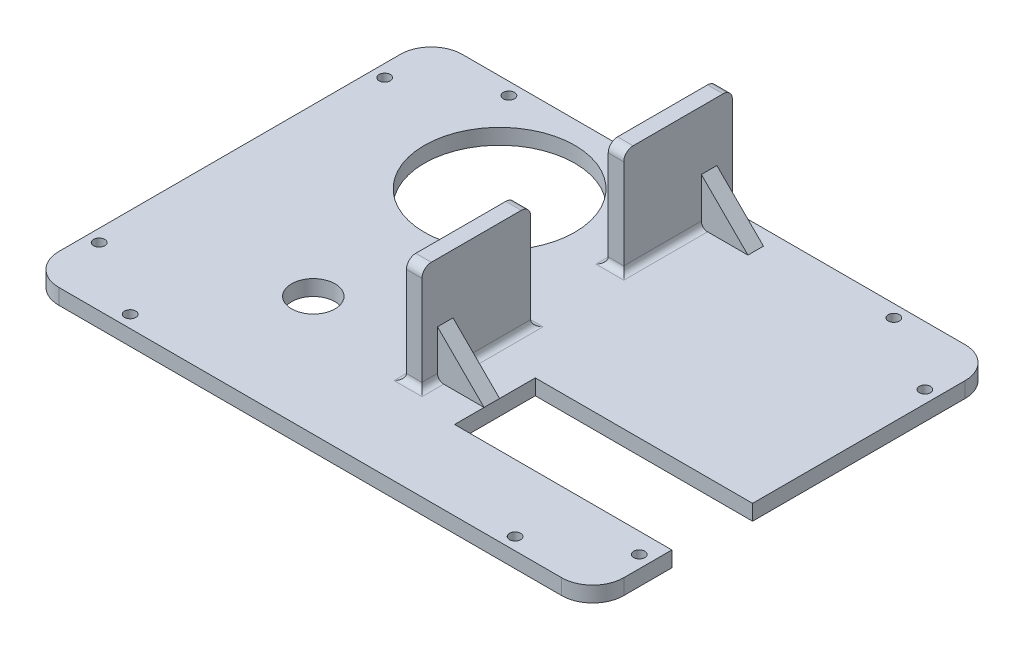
SolidWorks part; units mm, degrees
ref_plane "Front Plane" through (0, 0, 0) normal (0, 0, 1) x (1, 0, 0)
ref_plane "Top Plane" through (0, 0, 0) normal (0, 1, 0) x (1, 0, 0)
ref_plane "Right Plane" through (0, 0, 0) normal (1, 0, 0) x (0, 0, -1)
sketch "Sketch1" plane through (0, 0, 0) normal (0, 1, 0) x (1, 0, 0)
  line L26 (128.5, 13) -> (58.5, 13)
  line L27 (-43.5, 91.5) -> (118.5, 91.5)
  line L28 (-53.5, 81.5) -> (-53.5, -28.5)
  line L29 (-43.5, -38.5) -> (118.5, -38.5)
  line L30 (128.5, 81.5) -> (128.5, -28.5)
  line L31 (58.5, 13) -> (58.5, -13)
  line L32 (58.5, -13) -> (128.5, -13)
  circle A17 centre (0, 60) radius 24.25
  circle A18 centre (0, 0) radius 7
  arc A19 (-43.5, 91.5) -> (-53.5, 81.5) centre (-43.5, 81.5) ccw
  arc A20 (118.5, 91.5) -> (128.5, 81.5) centre (118.5, 81.5) cw
  arc A21 (118.5, -38.5) -> (128.5, -28.5) centre (118.5, -28.5) ccw
  arc A22 (-53.5, -28.5) -> (-43.5, -38.5) centre (-43.5, -28.5) ccw
  point P37 (0, 0)
  dimension "D3" = 60
  dimension "D4" = 10
  dimension "D5" = 130
  dimension "D6" = 38.5
  dimension "D7" = 25.5
  dimension "D22" = 48.5
  dimension "D1" = 14
  dimension "D20" = 26
  dimension "D21" = 70
extrude "Boss-Extrude1" add sketch "Sketch1" along normal blind 5
sketch "Sketch4" plane through (0, 5, 0) normal (0, 1, 0) x (1, 0, 0)
  line L0 (43.5, 91.5) -> (43.5, 56.5)
  line L1 (-53.5, 81.5) -> (-53.5, -28.5) construction
  line L2 (43.5, -8.5) -> (38.5, -8.5)
  line L3 (38.5, -8.5) -> (38.5, 26.5)
  line L4 (38.5, 91.5) -> (43.5, 91.5)
  line L5 (-43.5, 91.5) -> (118.5, 91.5) construction
  line L6 (38.5, 56.5) -> (43.5, 56.5)
  line L7 (38.5, 26.5) -> (43.5, 26.5)
  line L8 (43.5, 26.5) -> (43.5, -8.5)
  line L9 (38.5, 56.5) -> (38.5, 91.5)
  dimension "D1" = 97
  dimension "D2" = 5
  dimension "D3" = 100
  dimension "D4" = 35
  dimension "D5" = 35
extrude "Boss-Extrude3" add sketch "Sketch4" along normal blind 34
other "Gusset1" parameters "D1"=5, "D2"=5, "D3"=0, "D4"=0, "D10"=5, "D11"=15, "D12"=15, "D13"=15, "D14"=45, "D15"=15, "D16"=5, "D17"=5, "D18"=45
sketch "Sketch5" plane through (38.5, 5, -74) normal (0, 0, -1) x (-1, 0, 0)
  line L0 (0, 0) -> (15, 0)
  line L1 (0, 0) -> (0, 15)
  line L2 (15, 0) -> (0, 15)
other "Gusset2" parameters "D1"=5, "D2"=5, "D3"=0, "D4"=0, "D10"=5, "D11"=15, "D12"=15, "D13"=15, "D14"=45, "D15"=15, "D16"=7.5, "D17"=7.5, "D18"=45
sketch "Sketch6" plane through (38.5, 5, -21.5) normal (0, 0, 1) x (1, 0, 0)
  line L0 (0, 0) -> (-15, 0)
  line L1 (0, 0) -> (0, 15)
  line L2 (-15, 0) -> (0, 15)
other "Gusset3" parameters "D1"=5, "D2"=5, "D3"=0, "D4"=0, "D10"=5, "D11"=15, "D12"=15, "D13"=15, "D14"=45, "D15"=15, "D16"=7.5, "D17"=7.5, "D18"=45
sketch "Sketch7" plane through (43.5, 5, -86.5) normal (0, 0, 1) x (1, 0, 0)
  line L0 (0, 0) -> (0, 15)
  line L1 (0, 0) -> (15, 0)
  line L2 (0, 15) -> (15, 0)
other "Gusset4" parameters "D1"=5, "D2"=5, "D3"=0, "D4"=0, "D10"=5, "D11"=15, "D12"=15, "D13"=15, "D14"=45, "D15"=15, "D16"=7.5, "D17"=7.5, "D18"=45
sketch "Sketch8" plane through (43.5, 5, 3.5) normal (0, 0, -1) x (-1, 0, 0)
  line L0 (0, 0) -> (-15, 0)
  line L1 (0, 0) -> (0, 15)
  line L2 (-15, 0) -> (0, 15)
fillet "Fillet2" radius 2 7 edges at (38.5, 5, -74) (41, 5, -56.5) (43.5, 5, -74) (41, 5, -26.5) (38.5, 5, -9) (41, 5, 8.5) (43.5, 5, -9)
fillet "Fillet3" radius 3 4 edges at (41, 39, -91.5) (41, 39, -56.5) (41, 39, 8.5) (41, 39, -26.5)
sketch "Sketch9" plane through (0, 5, 0) normal (0, 1, 0) x (1, 0, 0)
  line L0 (-43.5, -38.5) -> (118.5, -38.5) construction
  line L1 (-53.5, 81.5) -> (-53.5, -28.5) construction
  line L2 (-53.5, 26.5) -> (-37.2936, 26.5) construction
  line L3 (37.5, -38.5) -> (37.5, -17.4731) construction
  circle A0 centre (-49.5, -19.5) radius 1.8
  circle A1 centre (-24.5, -34.5) radius 1.8
  circle A2 centre (99.5, -34.5) radius 1.8
  circle A3 centre (124.5, -19.5) radius 1.8
  circle A4 centre (124.5, 72.5) radius 1.8
  circle A5 centre (99.5, 87.5) radius 1.8
  circle A6 centre (-24.5, 87.5) radius 1.8
  circle A7 centre (-49.5, 72.5) radius 1.8
  dimension "D1" = 3.6
  dimension "D2" = 3.6
  dimension "D5" = 19
  dimension "D6" = 29
  dimension "D3" = 4
  dimension "D4" = 4
extrude "Cut-Extrude1" cut sketch "Sketch9" against normal through all
